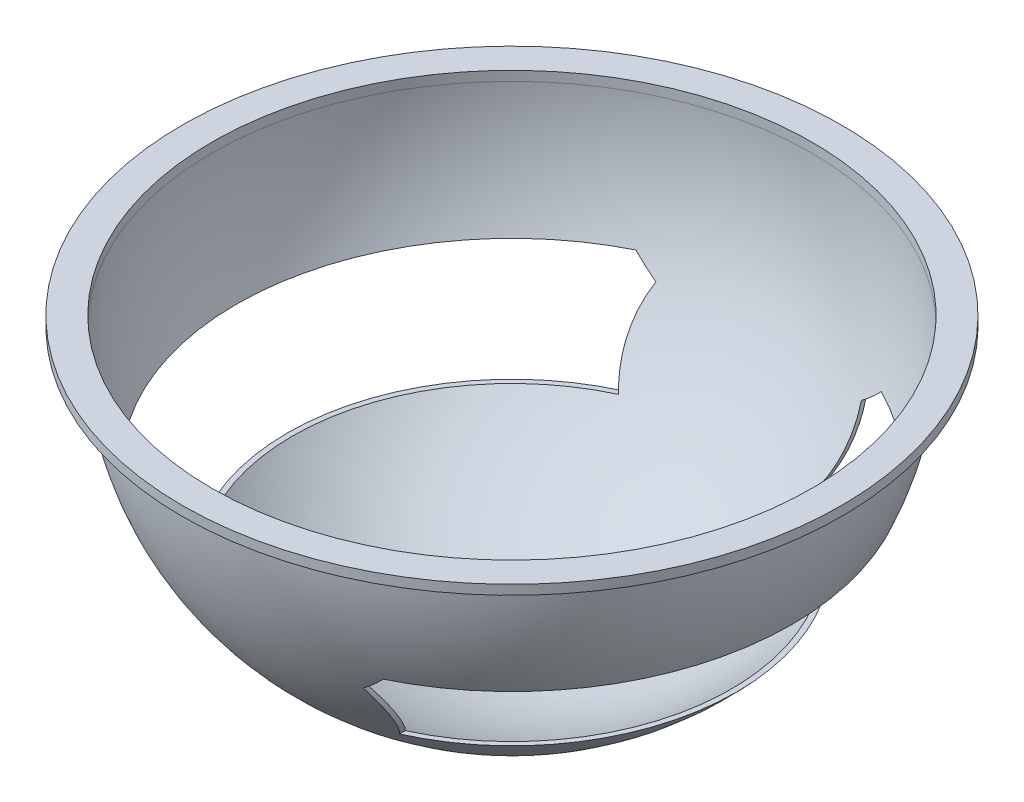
SolidWorks part; units mm, degrees
ref_plane "Front Plane" through (0, 0, 0) normal (0, 0, 1) x (1, 0, 0)
ref_plane "Top Plane" through (0, 0, 0) normal (0, 1, 0) x (1, 0, 0)
ref_plane "Right Plane" through (0, 0, 0) normal (1, 0, 0) x (0, 0, -1)
sketch "Sketch1" plane through (0, 0, 0) normal (0, 0, 1) x (1, 0, 0)
  line L0 (0, 0) -> (0, -293.9226) construction
  line L1 (-222.885, 0) -> (-197.5401, 0) construction
  line L2 (-201.93, 0) -> (-199.39, 0)
  line L3 (0, -201.93) -> (0, -199.39)
  arc A0 (-201.93, 0) -> (0, -201.93) centre (0, 0) ccw
  arc A1 (-201.93, 0) -> (-136.9782, -148.3667) centre (0, 0) ccw construction
  arc A2 (-199.39, 0) -> (0, -199.39) centre (0, 0) ccw
  dimension "D1" = 2.54
revolve "Revolve1" add sketch "Sketch1" angle 360 about L0
sketch "Sketch2" plane through (0, 0, 0) normal (0, 0, 1) x (1, 0, 0)
  line L0 (130.9336, -129.667) -> (154.7973, -129.667) construction
  line L1 (123.063, -129.667) -> (130.9336, -129.667) construction
  line L2 (72.4968, -129.667) -> (124.1391, -129.667) construction
  line L3 (183.0677, -85.217) -> (84.1905, -85.217) construction
  line L8 (183.0677, -85.217) -> (84.1905, -85.217) construction
  line L9 (72.4968, -129.667) -> (123.063, -129.667) construction
  line L10 (123.063, -129.667) -> (130.9336, -129.667) construction
  line L11 (130.9336, -129.667) -> (154.7973, -129.667) construction
  line L12 (183.0677, -78.867) -> (81.541, -78.867)
  line L13 (61.3512, -136.017) -> (123.063, -136.017)
  line L14 (123.063, -136.017) -> (130.9336, -136.017)
  line L15 (130.9336, -136.017) -> (154.7973, -136.017)
  line L16 (183.0677, -78.867) -> (209.5128, -78.867)
  line L17 (209.5128, -78.867) -> (209.5128, -136.017)
  line L18 (209.5128, -136.017) -> (154.7973, -136.017)
  arc A0 (75.7051, -92.837) -> (84.1905, -85.217) centre (0, 0) ccw construction
  arc A2 (75.7051, -92.837) -> (84.1905, -85.217) centre (0, 0) ccw construction
  arc A3 (68.3015, -90.5751) -> (81.541, -78.867) centre (0, 0) ccw
  ellipse E0 centre (0, -106.9207) end of major axis (-77.6329, -106.9207) minor radius 63.5931 (72.4968, -129.667) -> (75.7051, -92.837) ccw construction
  ellipse E2 centre (0, -106.9207) end of major axis (-77.6329, -106.9207) minor radius 63.5931 (72.4968, -129.667) -> (75.7051, -92.837) ccw construction
  spline S0 degree 1 poles (61.3512, -136.017) (68.3015, -90.5751) knots 0 0 1 1 construction
  spline S1 degree 3 poles (68.3015, -90.5751) (68.9967, -92.4409) (70.1642, -96.2828) (71.1527, -102.0923) (71.3965, -107.9572) (70.8885, -113.8094) (69.6324, -119.6021) (67.6346, -125.2795) (65.3591, -129.8711) (63.1873, -133.4238) (61.9773, -135.1673) (61.3512, -136.017) knots 2.598513 2.598513 2.598513 2.598513 2.703424 2.808335 2.913246 3.018157 3.123067 3.227978 3.332889 3.385345 3.4378 3.4378 3.4378 3.4378
  dimension "D1" = 6.35
extrude "Cut-Extrude1" cut sketch "Sketch2" against normal through all and the other way through all
mirror "Mirror1" about plane through (0, 0, 0) normal (1, 0, 0) of "Cut-Extrude1"
sketch "Sketch3" plane through (0, 0, 0) normal (0, 1, 0) x (1, 0, 0)
  circle A0 centre (0, 0) radius 199.39 construction
  circle A1 centre (0, 0) radius 199.39
  circle A2 centre (0, 0) radius 219.075
  dimension "D1" = 438.15
extrude "Boss-Extrude1" add sketch "Sketch3" along normal blind 6.35
